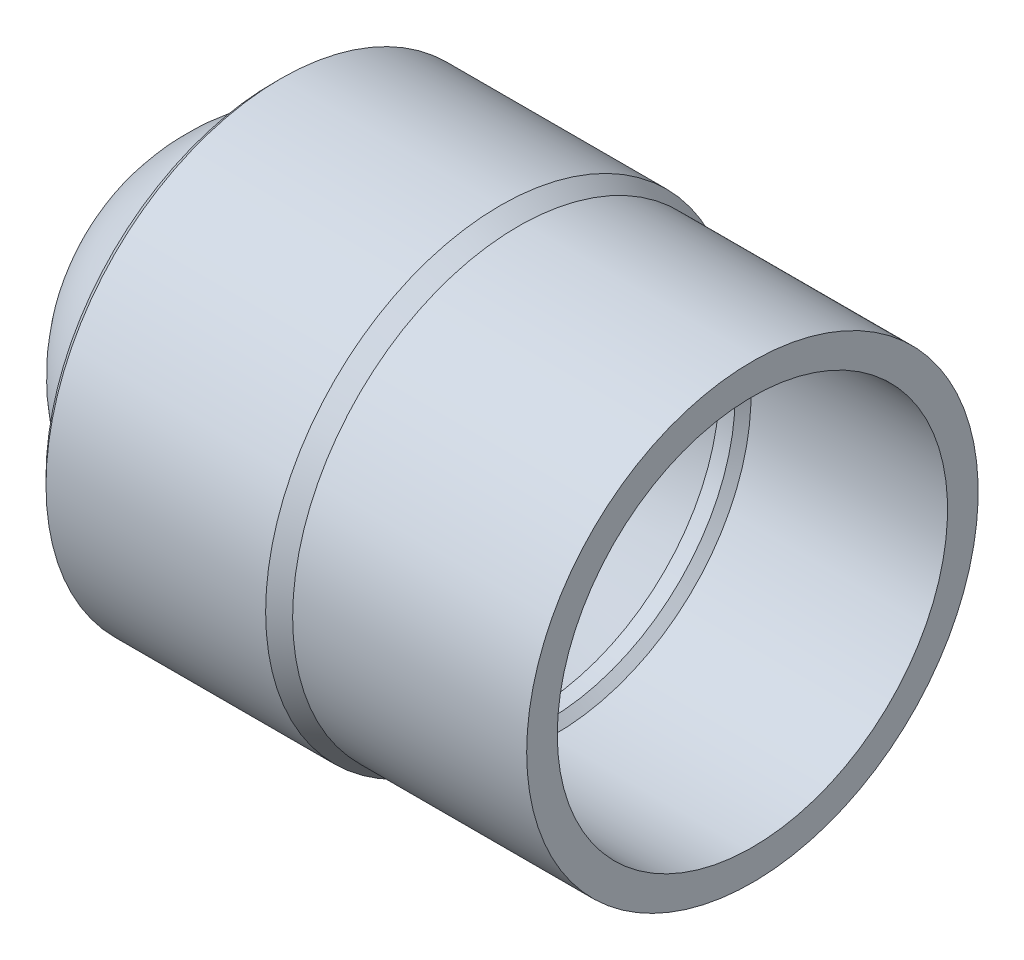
SolidWorks part; units mm, degrees
ref_plane "Front Plane" through (0, 0, 0) normal (0, 0, 1) x (1, 0, 0)
ref_plane "Top Plane" through (0, 0, 0) normal (0, 1, 0) x (1, 0, 0)
ref_plane "Right Plane" through (0, 0, 0) normal (1, 0, 0) x (0, 0, -1)
sketch "Sketch1" plane through (0, 0, 0) normal (0, 1, 0) x (1, 0, 0)
  line L0 (0, 0) -> (0, 57.404) construction
  line L1 (-19.05, 80.264) -> (-16.51, 82.804)
  line L2 (54.61, 57.404) -> (0, 57.404)
  line L3 (54.61, 57.404) -> (72.1487, 66.04)
  line L4 (72.1487, 66.04) -> (77.724, 66.04)
  line L5 (77.724, 66.04) -> (80.518, 68.834)
  line L6 (80.518, 68.834) -> (149.86, 68.834)
  line L7 (-57.404, 0) -> (-70.104, 0)
  line L8 (149.86, 0) -> (149.86, 68.834) construction
  line L9 (-19.05, 70.104) -> (0, 70.104)
  line L10 (-19.05, 70.104) -> (-19.05, 80.264)
  line L11 (60.96, 82.804) -> (67.31, 79.629)
  line L12 (149.86, 79.629) -> (149.86, 68.834)
  line L13 (67.31, 79.629) -> (149.86, 79.629)
  line L14 (-16.51, 82.804) -> (60.96, 82.804)
  line L15 (60.96, 82.804) -> (149.86, 82.804) construction
  line L16 (149.86, 79.629) -> (149.86, 82.804) construction
  line L17 (0, 0) -> (149.86, 0) construction
  line L18 (-57.404, 0) -> (0, 0) construction
  arc A0 (0, 70.104) -> (-70.104, 0) centre (0, 0) ccw
  arc A1 (0, 57.404) -> (-57.404, 0) centre (0, 0) ccw
  point P13 (-73.3298, 0)
  point P15 (-19.05, 82.804)
  dimension "D12" = 19.05
  dimension "D15" = 10.795
  dimension "D6" = 54.61
  dimension "D17" = 70.104
  dimension "D4" = 57.404
  dimension "D2" = 69.342
  dimension "D3" = 72.136
  dimension "D5" = 95.25
  dimension "D7" = 72.1487
  dimension "D8" = 12.7
  dimension "D9" = 57.404
  dimension "D10" = 68.834
  dimension "D11" = 12.7
  dimension "D13" = 135
  dimension "D14" = 88.9
  dimension "D16" = 6.35
revolve "Revolve1" add sketch "Sketch1" angle 360 about L17
